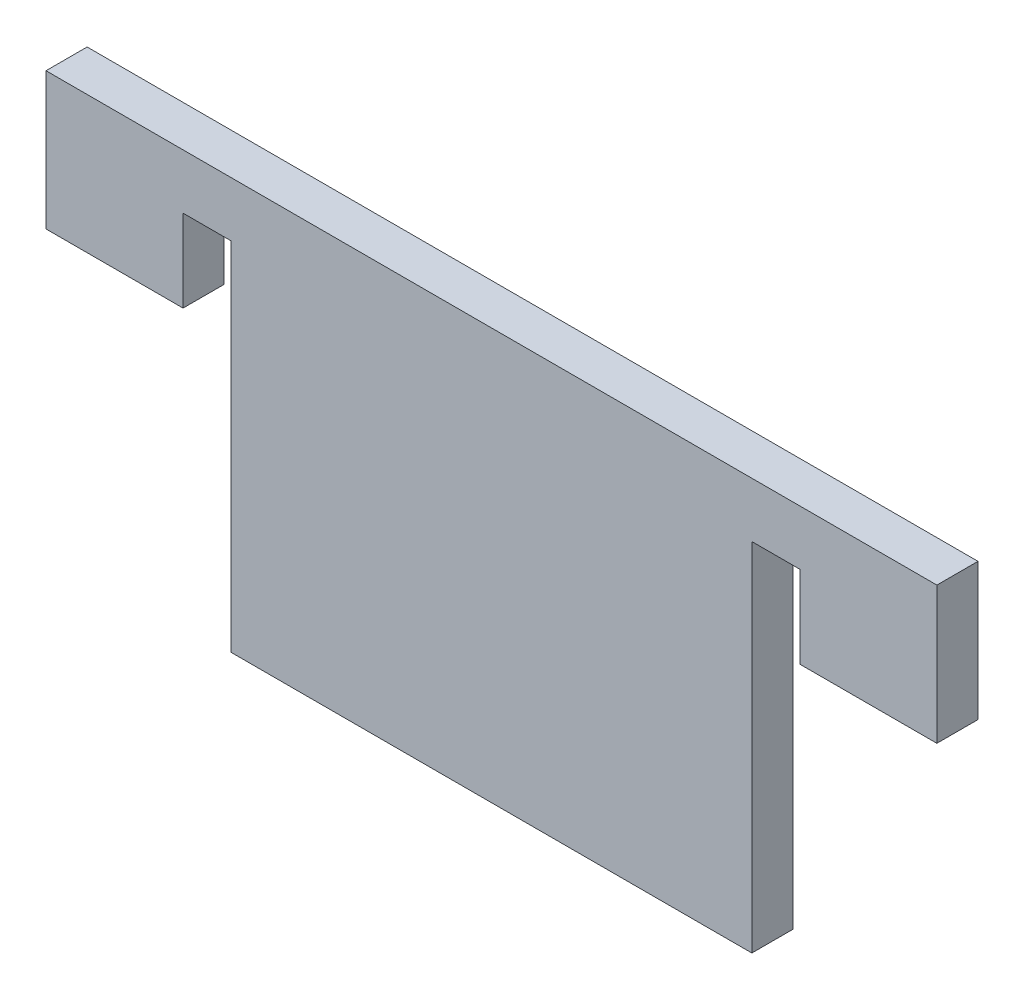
SolidWorks part; units mm, degrees
ref_plane "Plan de face" through (0, 0, 0) normal (0, 0, 1) x (1, 0, 0)
ref_plane "Plan de dessus" through (0, 0, 0) normal (0, 1, 0) x (1, 0, 0)
ref_plane "Plan de droite" through (0, 0, 0) normal (1, 0, 0) x (0, 0, -1)
sketch "Esquisse1" plane through (0, 0, 0) normal (0, 0, 1) x (1, 0, 0)
  line L1 (0, 0) -> (65, 0)
  line L2 (0, 0) -> (0, 30)
  line L3 (0, 30) -> (65, 30)
  line L4 (65, 0) -> (65, 30)
  dimension "D1" = 65
  dimension "D2" = 30
extrude "Extrusion1" add sketch "Esquisse1" along normal blind 3
sketch "Esquisse2" plane through (0, 0, 3) normal (0, 0, 1) x (1, 0, 0)
  line L1 (0, 0) -> (13.5, 0)
  line L2 (0, 0) -> (0, 20)
  line L3 (0, 20) -> (13.5, 20)
  line L4 (13.5, 0) -> (13.5, 20)
  line L5 (65, 0) -> (51.5, 0)
  line L6 (65, 0) -> (65, 20)
  line L7 (65, 20) -> (51.5, 20)
  line L8 (51.5, 0) -> (51.5, 20)
  dimension "D1" = 13.5
  dimension "D2" = 13.5
  dimension "D3" = 20
  dimension "D4" = 20
extrude "Enlèv. mat.-Extru.1" cut sketch "Esquisse2" against normal blind 3
sketch "Esquisse3" plane through (0, 0, 3) normal (0, 0, 1) x (1, 0, 0)
  line L1 (13.5, 20) -> (10, 20)
  line L2 (13.5, 20) -> (13.5, 26)
  line L3 (13.5, 26) -> (10, 26)
  line L4 (10, 20) -> (10, 26)
  line L5 (51.5, 20) -> (55, 20)
  line L6 (51.5, 20) -> (51.5, 26)
  line L7 (51.5, 26) -> (55, 26)
  line L8 (55, 20) -> (55, 26)
  dimension "D1" = 3.5
  dimension "D2" = 3.5
  dimension "D3" = 6
  dimension "D4" = 6
extrude "Enlèv. mat.-Extru.2" cut sketch "Esquisse3" against normal blind 3
